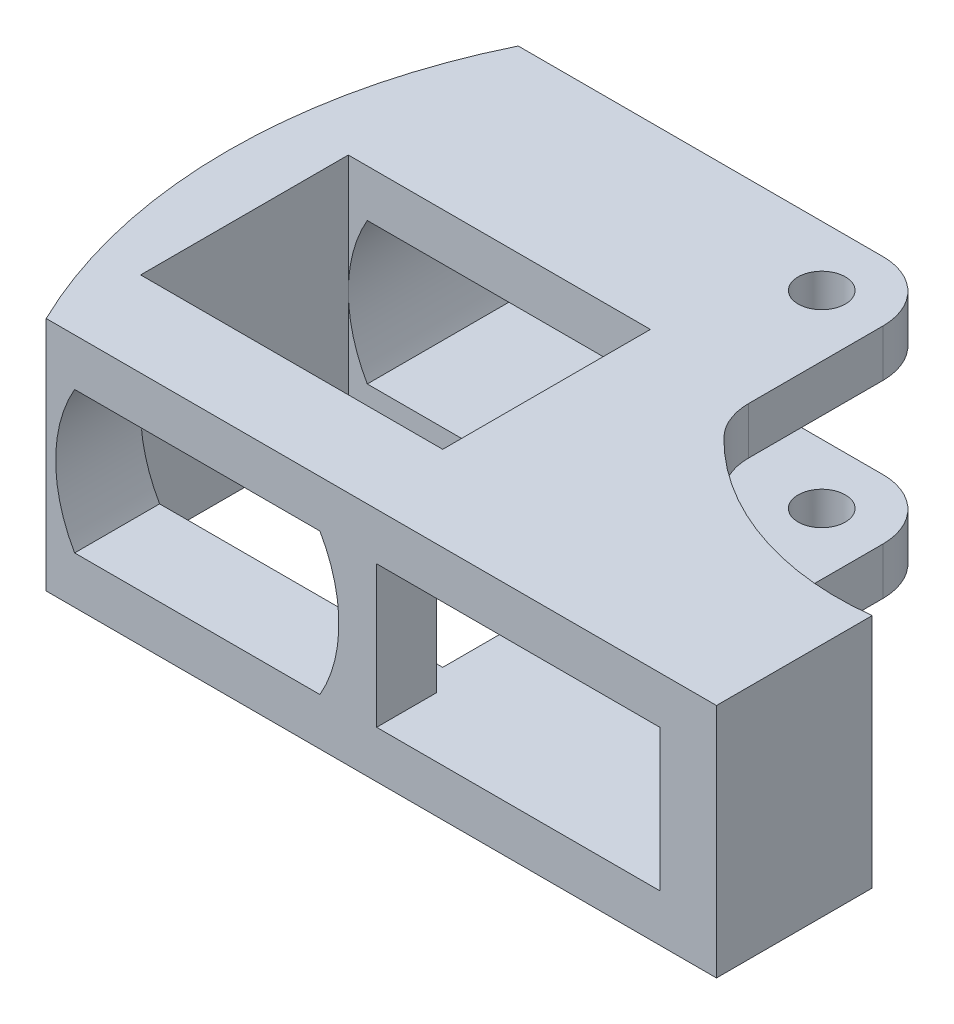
SolidWorks part; units mm, degrees
ref_plane "Front" through (0, 0, 0) normal (0, 0, 1) x (1, 0, 0)
ref_plane "Top" through (0, 0, 0) normal (0, 1, 0) x (1, 0, 0)
ref_plane "Right" through (0, 0, 0) normal (1, 0, 0) x (0, 0, -1)
sketch "Sketch1" plane through (0, 0, 0) normal (0, 1, 0) x (1, 0, 0)
  line L0 (-35.5, 0) -> (35.5, 0)
  line L1 (35.5, 0) -> (35.5, 16.5)
  line L2 (-35.5, 50) -> (9.5, 50)
  line L3 (9.5, 50) -> (9.5, 27)
  line L4 (-35.5, 50) -> (-35.5, 0) construction
  arc A0 (9.5, 27) -> (35.5, 16.5) centre (32.006, 45.2888) ccw
  arc A1 (-35.5, 50) -> (-35.5, 0) centre (15.725, 25) ccw
  dimension "D4" = 50
  dimension "D6" = 57
  dimension "D7" = 29
  dimension "D1" = 71
  dimension "D2" = 45
  dimension "D3" = 16.5
  dimension "D5" = 23
extrude "Boss-Extrude1" add sketch "Sketch1" along normal mid plane 25 contours L2 L3 A0 L1 L0 A1
fillet "Fillet1" radius 6.35 2 edges at (9.5, 0, -50) (9.5, 0, -27)
sketch "Sketch2" plane through (0, 12.5, 0) normal (0, 1, 0) x (1, 0, 0)
  line L0 (-35.5, 50) -> (3.15, 50) construction
  line L1 (-34.5, 31) -> (-2.5, 31)
  line L2 (-34.5, 31) -> (-34.5, 9)
  line L3 (-34.5, 9) -> (-2.5, 9)
  line L4 (-2.5, 31) -> (-2.5, 9)
  line L5 (35.5, 0) -> (35.5, 16.5) construction
  point P6 (35.5, 8.25)
  dimension "D1" = 22
  dimension "D2" = 19
  dimension "D3" = 32
  dimension "D4" = 38
extrude "Cut-Extrude1" cut sketch "Sketch2" against normal through all
sketch "Sketch3" plane through (0, 0, 0) normal (0, 0, 1) x (1, 0, 0)
  line L0 (35.5, 12.5) -> (35.5, -12.5) construction
  line L1 (-32.4904, 7.5) -> (-6.5096, 7.5)
  line L3 (-32.4904, -7.5) -> (-6.5096, -7.5)
  line L5 (-0.5, 7.5) -> (29.5, 7.5)
  line L6 (-0.5, 7.5) -> (-0.5, -7.5)
  line L7 (-0.5, -7.5) -> (29.5, -7.5)
  line L8 (29.5, 7.5) -> (29.5, -7.5)
  line L10 (-32.9622, 0) -> (36.7489, 0) construction
  arc A0 (-6.5096, -7.5) -> (-6.5096, 7.5) centre (-19.5, 0) ccw
  arc A1 (-32.4904, 7.5) -> (-32.4904, -7.5) centre (-19.5, 0) ccw
  point P2 (-4.5, 0)
  dimension "D2" = 30
  dimension "D1" = 15
  dimension "D3" = 4
  dimension "D4" = 30
  dimension "D5" = 6
extrude "Cut-Extrude2" cut sketch "Sketch3" against normal through all contours L1 L3
ref_plane "Plane1" through (0, 0, -6.35) normal (0, 0, 1) x (1, 0, 0)
sketch "Sketch7" plane through (0, 0, -50) normal (0, 0, -1) x (-1, 0, 0)
  line L0 (6.5096, 7.5) -> (32.4904, 7.5) construction
  line L1 (-9, -7.5) -> (9, -7.5)
  line L2 (-9, -7.5) -> (-9, 7.5)
  line L3 (-9, 7.5) -> (9, 7.5)
  line L4 (9, -7.5) -> (9, 7.5)
  line L5 (-9, -7.5) -> (9, 7.5) construction
  line L6 (-9, 7.5) -> (9, -7.5) construction
  point P0 (0, 0)
  dimension "D1" = 18
extrude "Cut-Extrude4" cut sketch "Sketch7" against normal up to surface (43.65 mm away)
sketch "Sketch8" plane through (0, 12.5, 0) normal (0, 1, 0) x (1, 0, 0)
  line L0 (9.5, 43.65) -> (9.5, 29.4141) construction
  line L1 (-35.5, 50) -> (3.15, 50) construction
  circle A0 centre (3, 43.65) radius 2.5
  dimension "D3" = 5
  dimension "D1" = 6.5
  dimension "D2" = 6.35
extrude "Cut-Extrude5" cut sketch "Sketch8" against normal through all
ref_plane "Plane3" through (-18.5, 0, 0) normal (-1, 0, 0) x (0, 0, 1)
